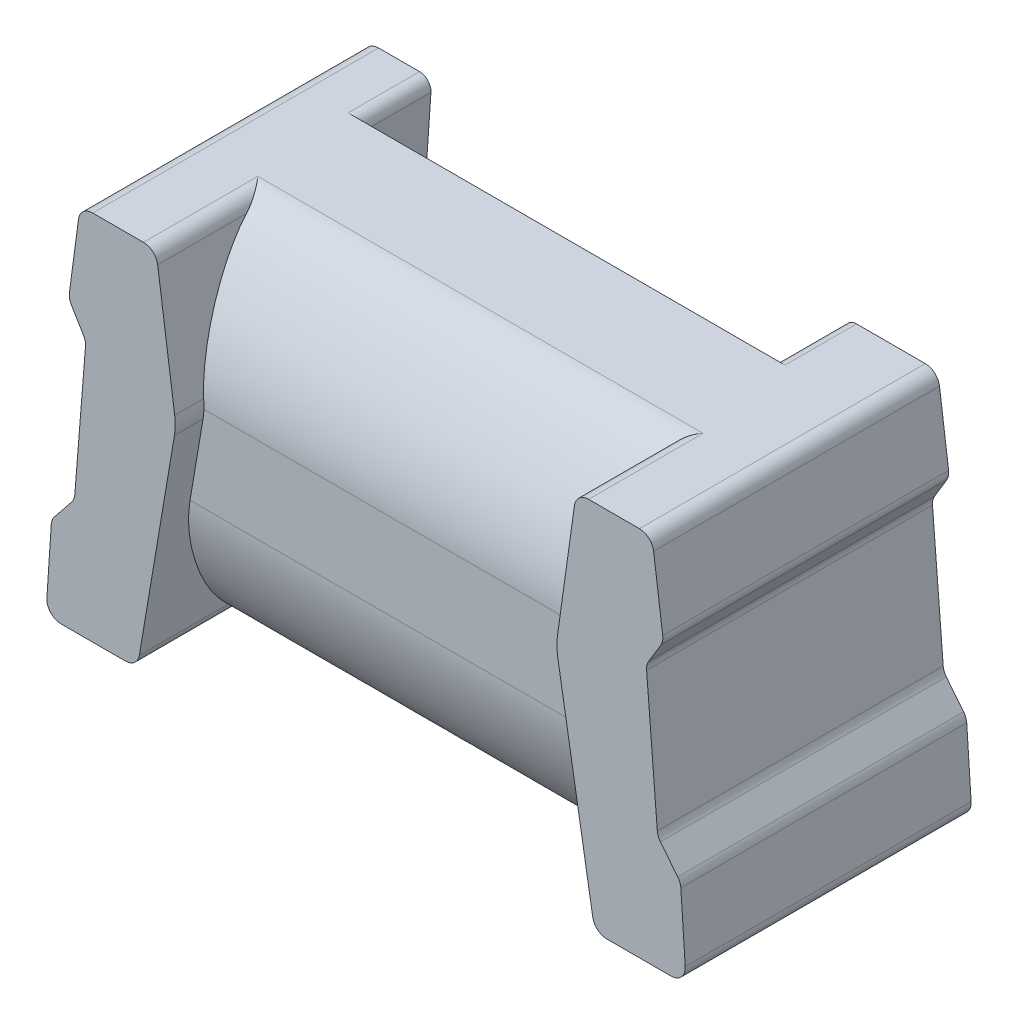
SolidWorks part; units mm, degrees
ref_plane "Спереди" through (0, 0, 0) normal (0, 0, 1) x (1, 0, 0)
ref_plane "Сверху" through (0, 0, 0) normal (0, 1, 0) x (1, 0, 0)
ref_plane "Справа" through (0, 0, 0) normal (1, 0, 0) x (0, 0, -1)
sketch "Эскиз1" plane through (0, 0, 0) normal (0, 0, 1) x (1, 0, 0)
  line L4 (11.2, 0) -> (11.2, 13) construction
  line L5 (0, 0) -> (0.2, 3)
  line L6 (0.2, 3) -> (1, 4)
  line L7 (1, 4) -> (1.4, 9)
  line L8 (1.4, 9) -> (0.8, 10)
  line L9 (0.8, 10) -> (1.2, 13)
  line L10 (1.2, 13) -> (21.2, 13)
  line L11 (0, 0) -> (22.4, 0)
  line L12 (21.6, 10) -> (21.2, 13)
  line L13 (21, 9) -> (21.6, 10)
  line L14 (21.4, 4) -> (21, 9)
  line L15 (22.2, 3) -> (21.4, 4)
  line L16 (22.4, 0) -> (22.2, 3)
  point P3 (21.4, 4)
  point P5 (22.2, 3)
  point P7 (0.8, 10)
  point P8 (1.4, 9)
  point P9 (0.2, 3)
  point P10 (1, 4)
  point P11 (21, 9)
  point P16 (21.6, 10)
  dimension "D2" = 10
  dimension "D3" = 11.2
  dimension "D4" = 13
  dimension "D5" = 10.4
  dimension "D6" = 3
  dimension "D7" = 9.8
  dimension "D8" = 3
  dimension "D9" = 11
  dimension "D10" = 4
  dimension "D11" = 10.2
  dimension "D12" = 4
extrude "Бобышка-Вытянуть1" add sketch "Эскиз1" along normal blind 10
sketch "Эскиз2" plane through (0, 0, 10) normal (0, 0, 1) x (1, 0, 0)
  line L0 (11.2, 13) -> (11.2, 0) construction
  line L1 (21.2, 13) -> (1.2, 13) construction
  line L2 (0, 0) -> (22.4, 0) construction
  line L3 (18.55, 13) -> (3.85, 13)
  line L4 (3.85, 13) -> (4.55, 8)
  line L5 (4.55, 8) -> (3.2, 0)
  line L6 (3.2, 0) -> (19.2, 0)
  line L7 (17.85, 8) -> (19.2, 0)
  line L8 (18.55, 13) -> (17.85, 8)
  dimension "D1" = 7.35
  dimension "D2" = 6.65
  dimension "D3" = 8
  dimension "D4" = 8
extrude "Вырез-Вытянуть2" cut sketch "Эскиз2" against normal blind 1
fillet "Скругление3" radius 3 1 edges at (11.2, 13, 9)
fillet "Скругление4" radius 3 1 edges at (11.2, 0, 9)
sketch "Эскиз3" plane through (0, 0, 0) normal (0, 0, -1) x (-1, 0, 0)
  line L0 (-11.2, 13) -> (-11.2, 0) construction
  line L1 (-21.2, 13) -> (-1.2, 13) construction
  line L2 (0, 0) -> (-22.4, 0) construction
  line L3 (-11.2, 13) -> (-17.9, 13)
  line L4 (-17.9, 13) -> (-19.1933, 3)
  line L5 (-19.1933, 3) -> (-17.4693, 1.8)
  line L6 (-17.4693, 1.8) -> (-17.5, 0)
  line L7 (-17.5, 0) -> (-11.2, 0)
  line L8 (-11.2, 0) -> (-4, 0)
  line L9 (-4, 0) -> (-3.9418, 2)
  line L10 (-3.9418, 2) -> (-2.7858, 2.7)
  line L11 (-2.7858, 2.7) -> (-3.5, 13)
  line L12 (-3.5, 13) -> (-11.2, 13)
  line L13 (-22.4, 0) -> (-22.2, 3) construction
  line L14 (-0.2, 3) -> (0, 0) construction
  point P20 (0, 0)
  point P22 (-3.3455, -1.2275)
  dimension "D1" = 3.3
  dimension "D2" = 2.3
  dimension "D3" = 4
  dimension "D4" = 4.9
  dimension "D5" = 1.8
  dimension "D6" = 4.8
  dimension "D7" = 3
  dimension "D8" = 3
  dimension "D9" = 2
  dimension "D10" = 3.8
  dimension "D11" = 2.7
  dimension "D12" = 2.6
extrude "Вырез-Вытянуть3" cut sketch "Эскиз3" against normal blind 2.5
fillet "Скругление5" radius 0.5 12 edges at (0, 0, 5) (0.2, 3, 5) (1, 4, 5) (1.4, 9, 5) (0.8, 10, 5) (1.2, 13, 5) (21.2, 13, 5) (22.4, 0, 5) (22.2, 3, 5) (21.4, 4, 5) (21, 9, 5) (21.6, 10, 5)
fillet "Скругление7" radius 0.4 8 edges at (2.7858, 2.7, 1.25) (4, 0, 1.25) (3.9418, 2, 1.25) (3.5, 13, 1.25) (17.9, 13, 1.25) (17.5, 0, 1.25) (17.4693, 1.8, 1.25) (19.1933, 3, 1.25)
fillet "Скругление9" radius 2 2 edges
fillet "Скругление10" radius 0.5 4 edges
